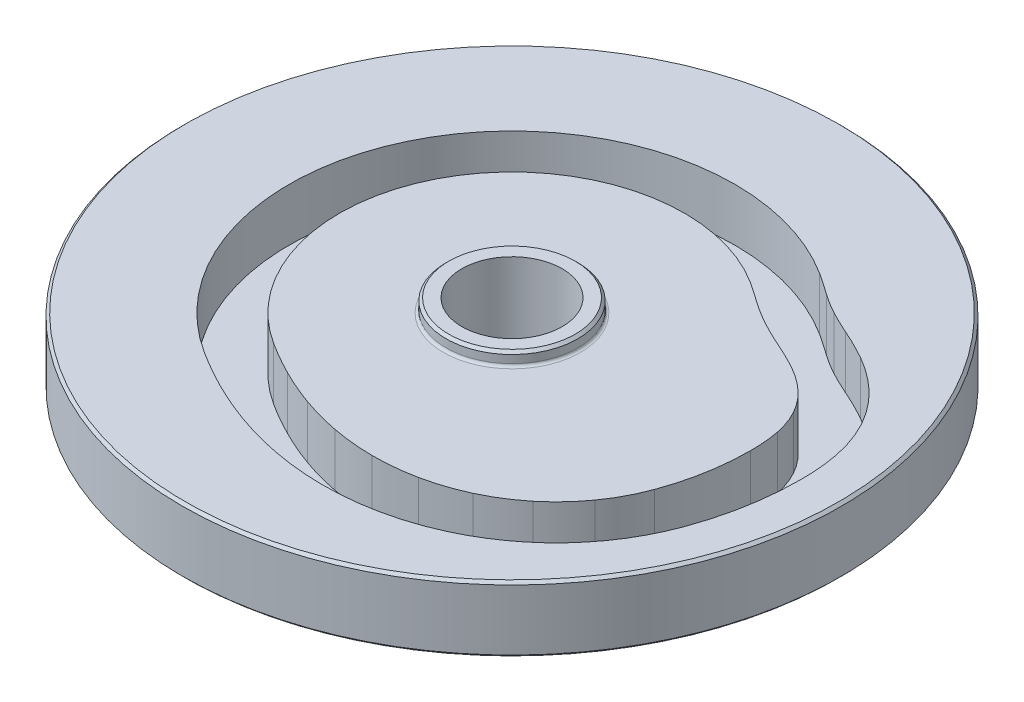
SolidWorks part; units mm, degrees
ref_plane "Front" through (0, 0, 0) normal (0, 0, 1) x (1, 0, 0)
ref_plane "Top" through (0, 0, 0) normal (0, 1, 0) x (1, 0, 0)
ref_plane "Right" through (0, 0, 0) normal (1, 0, 0) x (0, 0, -1)
sketch "Sketch1" plane through (0, 0, 0) normal (0, 0, 1) x (1, 0, 0)
  line L0 (0, -30350) -> (0, 355) construction
  line L1 (19.05, 5) -> (24, 5)
  line L2 (24, 5) -> (25, 4)
  line L3 (25, 4) -> (25, 1)
  line L4 (26, 0) -> (124, 0)
  line L5 (124, 0) -> (125, -1)
  line L6 (125, -1) -> (125, -24)
  line L7 (125, -24) -> (124, -25)
  line L8 (124, -25) -> (26, -25)
  line L9 (25, -26) -> (25, -29)
  line L10 (25, -29) -> (24, -30)
  line L11 (24, -30) -> (19.05, -30)
  line L12 (19.05, -30) -> (19.05, 5)
  arc A0 (25, 1) -> (26, 0) centre (26, 1) ccw
  arc A1 (26, -25) -> (25, -26) centre (26, -26) ccw
revolve "Revolve1" add sketch "Sketch1" angle 360 about L0
sketch "Sketch2" plane through (0, 0, 0) normal (0, 1, 0) x (1, 0, 0)
  line L0 (0, 0) -> (100, 0) construction
  arc A0 (100, 0) -> (98.8357, 13.0115) centre (35.1621, 0.756) ccw
  arc A1 (98.8357, 13.0115) -> (94.4055, 25.2692) centre (56.5582, 4.6609) ccw
  arc A2 (94.4055, 25.2692) -> (86.4082, 35.5582) centre (57.7012, 4.9924) ccw
  arc A3 (86.4082, 35.5582) -> (76.1666, 43.0686) centre (49.5088, -4.0212) ccw
  arc A4 (76.1666, 43.0686) -> (65.7386, 48.2775) centre (17.0985, -62.1401) ccw
  arc A5 (65.7386, 48.2775) -> (56.4654, 52.7493) centre (126.41, 185.9441) cw
  arc A6 (56.4654, 52.7493) -> (48.2764, 57.8032) centre (97.8381, 128.9475) cw
  arc A7 (48.2764, 57.8032) -> (40.2312, 63.2965) centre (-118.4006, -177.6649) ccw
  arc A8 (40.2312, 63.2965) -> (-40.2312, -63.2965) centre (0, 0) ccw
  arc A9 (-40.2312, -63.2965) -> (-27.3421, -70.6474) centre (40.8941, 63.9741) ccw
  arc A10 (-27.3421, -70.6474) -> (-12.9935, -76.8335) centre (29.3243, 41.0558) ccw
  arc A11 (-12.9935, -76.8335) -> (2.9489, -81.1965) centre (23.1016, 23.7507) ccw
  arc A12 (2.9489, -81.1965) -> (20.2342, -82.8956) centre (20.8417, 12.0552) ccw
  arc A13 (20.2342, -82.8956) -> (38.1992, -81.1273) centre (20.7804, 3.6953) ccw
  arc A14 (38.1992, -81.1273) -> (55.8267, -75.3156) centre (22.0381, -2.4696) ccw
  arc A15 (55.8267, -75.3156) -> (71.86, -65.2672) centre (23.9693, -6.6684) ccw
  arc A16 (71.86, -65.2672) -> (84.9698, -51.2829) centre (25.8253, -8.9741) ccw
  arc A17 (84.9698, -51.2829) -> (93.9693, -34.202) centre (26.92, -9.7867) ccw
  arc A18 (93.9693, -34.202) -> (100, 0) centre (0, 0) ccw
extrude "Cut-Extrude-Thin1" cut sketch "Sketch2" along normal blind 15 and the other way blind 20 thin
